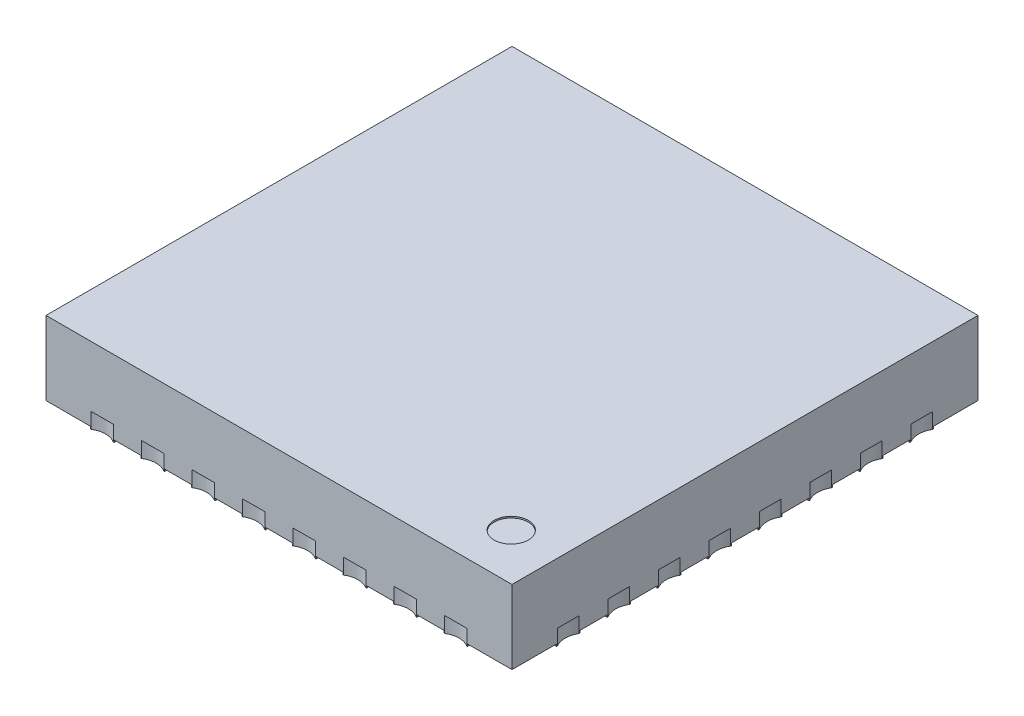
SolidWorks part; units mm, degrees
ref_plane "Plane1" through (0, 0, 0) normal (0, 0, 1) x (1, 0, 0)
ref_plane "Plane2" through (0, 0, 0) normal (0, 1, 0) x (1, 0, 0)
ref_plane "Plane3" through (0, 0, 0) normal (1, 0, 0) x (0, 0, -1)
sketch "Sketch1" plane through (0, 0, 0) normal (0, 1, 0) x (1, 0, 0)
  line L1 (0, 0) -> (6, 0)
  line L2 (0, 0) -> (0, 6)
  line L3 (0, 6) -> (6, 6)
  line L4 (6, 0) -> (6, 6)
  dimension "D1" = 6
  dimension "D2" = 6
extrude "Base-Extrude" add sketch "Sketch1" along normal blind 0.95
sketch "Sketch2" plane through (0, 0, 0) normal (0, -1, 0) x (1, 0, 0)
  line L0 (0.7, -0.7) -> (5, -0.7)
  line L1 (5.3, -1) -> (5.3, -5.3)
  line L2 (5.3, -5.3) -> (0.7, -5.3)
  line L3 (0.7, -5.3) -> (0.7, -0.7)
  line L4 (6, 0) -> (6, -6) construction
  line L5 (0, 0) -> (6, 0) construction
  line L6 (1.225, 0) -> (1.525, 0)
  line L7 (0.575, 0) -> (0.875, 0)
  line L8 (0.575, 0) -> (0.575, -0.4)
  line L9 (0.575, -0.4) -> (0.875, -0.4)
  line L10 (0.875, 0) -> (0.875, -0.4)
  line L11 (1.225, 0) -> (1.225, -0.4)
  line L12 (1.225, -0.4) -> (1.525, -0.4)
  line L13 (1.525, 0) -> (1.525, -0.4)
  line L14 (1.875, 0) -> (2.175, 0)
  line L15 (1.875, 0) -> (1.875, -0.4)
  line L16 (1.875, -0.4) -> (2.175, -0.4)
  line L17 (2.175, 0) -> (2.175, -0.4)
  line L18 (2.525, 0) -> (2.825, 0)
  line L19 (2.525, 0) -> (2.525, -0.4)
  line L20 (2.525, -0.4) -> (2.825, -0.4)
  line L21 (2.825, 0) -> (2.825, -0.4)
  line L22 (3.175, 0) -> (3.475, 0)
  line L23 (3.175, 0) -> (3.175, -0.4)
  line L24 (3.175, -0.4) -> (3.475, -0.4)
  line L25 (3.475, 0) -> (3.475, -0.4)
  line L26 (3.825, 0) -> (4.125, 0)
  line L27 (3.825, 0) -> (3.825, -0.4)
  line L28 (3.825, -0.4) -> (4.125, -0.4)
  line L29 (4.125, 0) -> (4.125, -0.4)
  line L30 (4.475, 0) -> (4.775, 0)
  line L31 (4.475, 0) -> (4.475, -0.4)
  line L32 (4.475, -0.4) -> (4.775, -0.4)
  line L33 (4.775, 0) -> (4.775, -0.4)
  line L34 (5.125, 0) -> (5.425, 0)
  line L35 (5.125, 0) -> (5.125, -0.4)
  line L36 (5.125, -0.4) -> (5.425, -0.4)
  line L37 (5.425, 0) -> (5.425, -0.4)
  line L38 (1.225, -5.6) -> (1.525, -5.6)
  line L39 (0.575, -5.6) -> (0.875, -5.6)
  line L40 (0.575, -5.6) -> (0.575, -6)
  line L41 (0.575, -6) -> (0.875, -6)
  line L42 (0.875, -5.6) -> (0.875, -6)
  line L43 (1.225, -5.6) -> (1.225, -6)
  line L44 (1.225, -6) -> (1.525, -6)
  line L45 (1.525, -5.6) -> (1.525, -6)
  line L46 (1.875, -5.6) -> (2.175, -5.6)
  line L47 (1.875, -5.6) -> (1.875, -6)
  line L48 (1.875, -6) -> (2.175, -6)
  line L49 (2.175, -5.6) -> (2.175, -6)
  line L50 (2.525, -5.6) -> (2.825, -5.6)
  line L51 (2.525, -5.6) -> (2.525, -6)
  line L52 (2.525, -6) -> (2.825, -6)
  line L53 (2.825, -5.6) -> (2.825, -6)
  line L54 (3.175, -5.6) -> (3.475, -5.6)
  line L55 (3.175, -5.6) -> (3.175, -6)
  line L56 (3.175, -6) -> (3.475, -6)
  line L57 (3.475, -5.6) -> (3.475, -6)
  line L58 (3.825, -5.6) -> (4.125, -5.6)
  line L59 (3.825, -5.6) -> (3.825, -6)
  line L60 (3.825, -6) -> (4.125, -6)
  line L61 (4.125, -5.6) -> (4.125, -6)
  line L62 (4.475, -5.6) -> (4.775, -5.6)
  line L63 (4.475, -5.6) -> (4.475, -6)
  line L64 (4.475, -6) -> (4.775, -6)
  line L65 (4.775, -5.6) -> (4.775, -6)
  line L66 (5.125, -5.6) -> (5.425, -5.6)
  line L67 (5.125, -5.6) -> (5.125, -6)
  line L68 (5.125, -6) -> (5.425, -6)
  line L69 (5.425, -5.6) -> (5.425, -6)
  line L70 (5.6, -0.575) -> (6, -0.575)
  line L71 (0, -0.575) -> (0.4, -0.575)
  line L72 (0, -0.575) -> (0, -0.875)
  line L73 (0, -0.875) -> (0.4, -0.875)
  line L74 (0.4, -0.575) -> (0.4, -0.875)
  line L75 (5.6, -0.575) -> (5.6, -0.875)
  line L76 (5.6, -0.875) -> (6, -0.875)
  line L77 (6, -0.575) -> (6, -0.875)
  line L78 (0, -1.225) -> (0.4, -1.225)
  line L79 (0, -1.225) -> (0, -1.525)
  line L80 (0, -1.525) -> (0.4, -1.525)
  line L81 (0.4, -1.225) -> (0.4, -1.525)
  line L82 (5.6, -1.225) -> (6, -1.225)
  line L83 (5.6, -1.225) -> (5.6, -1.525)
  line L84 (5.6, -1.525) -> (6, -1.525)
  line L85 (6, -1.225) -> (6, -1.525)
  line L86 (0, -1.875) -> (0.4, -1.875)
  line L87 (0, -1.875) -> (0, -2.175)
  line L88 (0, -2.175) -> (0.4, -2.175)
  line L89 (0.4, -1.875) -> (0.4, -2.175)
  line L90 (5.6, -1.875) -> (6, -1.875)
  line L91 (5.6, -1.875) -> (5.6, -2.175)
  line L92 (5.6, -2.175) -> (6, -2.175)
  line L93 (6, -1.875) -> (6, -2.175)
  line L94 (0, -2.525) -> (0.4, -2.525)
  line L95 (0, -2.525) -> (0, -2.825)
  line L96 (0, -2.825) -> (0.4, -2.825)
  line L97 (0.4, -2.525) -> (0.4, -2.825)
  line L98 (5.6, -2.525) -> (6, -2.525)
  line L99 (5.6, -2.525) -> (5.6, -2.825)
  line L100 (5.6, -2.825) -> (6, -2.825)
  line L101 (6, -2.525) -> (6, -2.825)
  line L102 (0, -3.175) -> (0.4, -3.175)
  line L103 (0, -3.175) -> (0, -3.475)
  line L104 (0, -3.475) -> (0.4, -3.475)
  line L105 (0.4, -3.175) -> (0.4, -3.475)
  line L106 (5.6, -3.175) -> (6, -3.175)
  line L107 (5.6, -3.175) -> (5.6, -3.475)
  line L108 (5.6, -3.475) -> (6, -3.475)
  line L109 (6, -3.175) -> (6, -3.475)
  line L110 (0, -3.825) -> (0.4, -3.825)
  line L111 (0, -3.825) -> (0, -4.125)
  line L112 (0, -4.125) -> (0.4, -4.125)
  line L113 (0.4, -3.825) -> (0.4, -4.125)
  line L114 (5.6, -3.825) -> (6, -3.825)
  line L115 (5.6, -3.825) -> (5.6, -4.125)
  line L116 (5.6, -4.125) -> (6, -4.125)
  line L117 (6, -3.825) -> (6, -4.125)
  line L118 (0, -4.475) -> (0.4, -4.475)
  line L119 (0, -4.475) -> (0, -4.775)
  line L120 (0, -4.775) -> (0.4, -4.775)
  line L121 (0.4, -4.475) -> (0.4, -4.775)
  line L122 (5.6, -4.475) -> (6, -4.475)
  line L123 (5.6, -4.475) -> (5.6, -4.775)
  line L124 (5.6, -4.775) -> (6, -4.775)
  line L125 (6, -4.475) -> (6, -4.775)
  line L126 (0, -5.125) -> (0.4, -5.125)
  line L127 (0, -5.125) -> (0, -5.425)
  line L128 (0, -5.425) -> (0.4, -5.425)
  line L129 (0.4, -5.125) -> (0.4, -5.425)
  line L130 (5.6, -5.125) -> (6, -5.125)
  line L131 (5.6, -5.125) -> (5.6, -5.425)
  line L132 (5.6, -5.425) -> (6, -5.425)
  line L133 (6, -5.125) -> (6, -5.425)
  line L134 (5, -0.7) -> (5.3, -1)
  line L139 (0, -6) -> (0, 0) construction
  circle A0 centre (3, -2.45) radius 0.005
  point P0 (0.7, -0.7)
  point P1 (5.3, -0.7)
  dimension "D2" = 2.45
  dimension "D3" = 0.01
  dimension "D1" = 3
  dimension "D4" = 4.6
  dimension "D5" = 4.6
  dimension "D6" = 0.7
  dimension "D7" = 0.7
  dimension "D8" = 0.4
  dimension "D9" = 0.3
  dimension "D11" = 0.65
  dimension "D12" = 0.575
  dimension "D13" = 2
  dimension "D14" = 0.575
  dimension "D15" = 0.3
  dimension "D16" = 0.4
  dimension "D10" = 8
  dimension "D17" = 2
  dimension "D18" = 8
extrude "Boss-Extrude1" add sketch "Sketch2" along normal blind 0.03
sketch "Sketch3" plane through (0, -0.03, 0) normal (0, -1, 0) x (1, 0, 0)
  line L0 (0.725, -0.4) -> (0.725, 0.2286) construction
  line L1 (0.575, -0.4) -> (0.875, -0.4) construction
  line L2 (0.4, -0.725) -> (-0.2308, -0.725) construction
  line L3 (0.4, -0.875) -> (0.4, -0.575) construction
  line L4 (0, -3) -> (6, -3) construction
  line L5 (0, -3.175) -> (0, -2.825) construction
  line L6 (6, -2.825) -> (6, -3.175) construction
  line L7 (3, -6) -> (3, 0) construction
  line L8 (3.175, -6) -> (2.825, -6) construction
  line L9 (2.825, 0) -> (3.175, 0) construction
  circle A0 centre (-0.2308, -0.725) radius 0.2701
  circle A1 centre (0.725, -6.2286) radius 0.2701
  circle A2 centre (6.2308, -0.725) radius 0.2701
  circle A3 centre (1.375, 0.2286) radius 0.2701
  circle A4 centre (1.375, -6.2286) radius 0.2701
  circle A5 centre (2.025, 0.2286) radius 0.2701
  circle A6 centre (0.725, 0.2286) radius 0.2701
  circle A7 centre (2.025, -6.2286) radius 0.2701
  circle A8 centre (2.675, 0.2286) radius 0.2701
  circle A9 centre (2.675, -6.2286) radius 0.2701
  circle A10 centre (3.325, 0.2286) radius 0.2701
  circle A11 centre (3.325, -6.2286) radius 0.2701
  circle A12 centre (3.975, 0.2286) radius 0.2701
  circle A13 centre (3.975, -6.2286) radius 0.2701
  circle A14 centre (4.625, 0.2286) radius 0.2701
  circle A15 centre (4.625, -6.2286) radius 0.2701
  circle A16 centre (5.275, 0.2286) radius 0.2701
  circle A17 centre (5.275, -6.2286) radius 0.2701
  circle A18 centre (-0.2308, -1.375) radius 0.2701
  circle A19 centre (6.2308, -1.375) radius 0.2701
  circle A20 centre (-0.2308, -2.025) radius 0.2701
  circle A21 centre (6.2308, -2.025) radius 0.2701
  circle A22 centre (-0.2308, -2.675) radius 0.2701
  circle A23 centre (6.2308, -2.675) radius 0.2701
  circle A24 centre (-0.2308, -3.325) radius 0.2701
  circle A25 centre (6.2308, -3.325) radius 0.2701
  circle A26 centre (-0.2308, -3.975) radius 0.2701
  circle A27 centre (6.2308, -3.975) radius 0.2701
  circle A28 centre (-0.2308, -4.625) radius 0.2701
  circle A29 centre (6.2308, -4.625) radius 0.2701
  circle A30 centre (-0.2308, -5.275) radius 0.2701
  circle A31 centre (6.2308, -5.275) radius 0.2701
  dimension "D1" = 8
  dimension "D2" = 8
extrude "Cut-Extrude1" cut sketch "Sketch3" against normal blind 0.2
sketch "Sketch5" plane through (0, 0.95, 0) normal (0, 1, 0) x (-1, 0, 0)
  line L0 (0, 0) -> (-6, 0) construction
  line L1 (-6, 0) -> (-6, -6) construction
  circle A0 centre (-5.39, -0.6) radius 0.22
  dimension "D2" = 0.61
  dimension "D1" = 0.6
extrude "Cut-Extrude3" cut sketch "Sketch5" against normal blind 0.02
